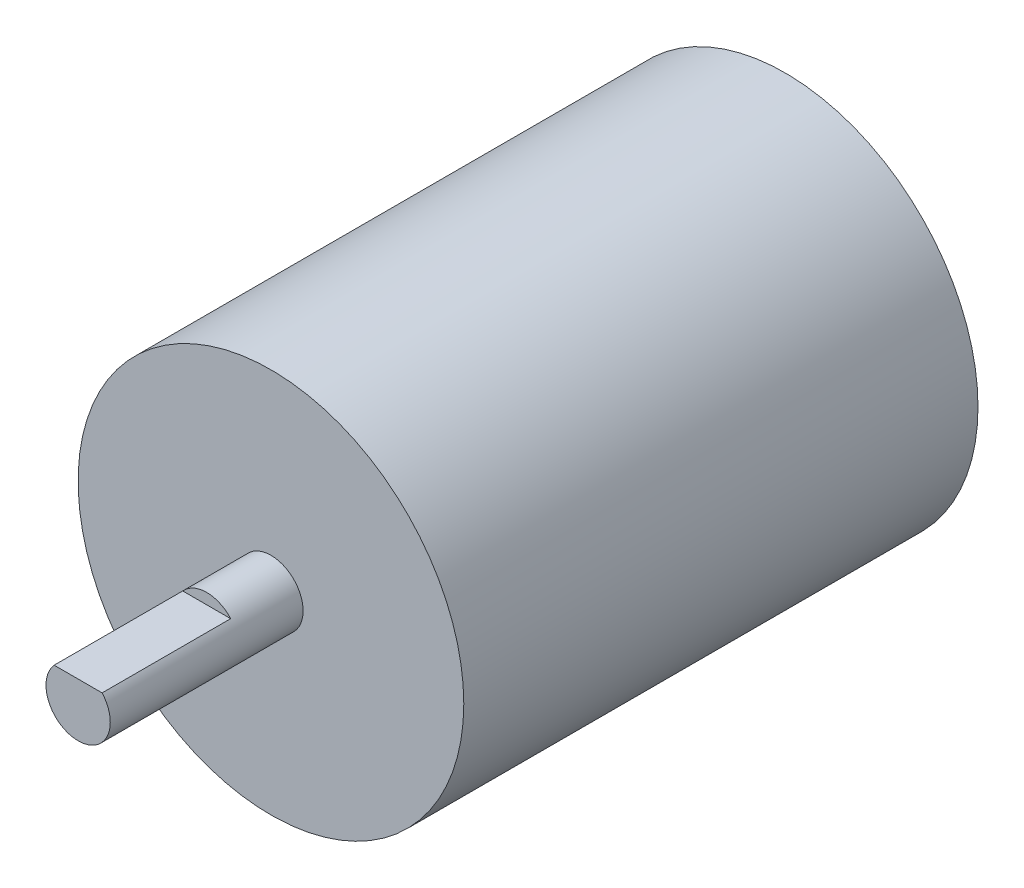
SolidWorks part; units mm, degrees
ref_plane "Front Plane" through (0, 0, 0) normal (0, 0, 1) x (1, 0, 0)
ref_plane "Top Plane" through (0, 0, 0) normal (0, 1, 0) x (1, 0, 0)
ref_plane "Right Plane" through (0, 0, 0) normal (1, 0, 0) x (0, 0, -1)
sketch "Sketch1" plane through (0, 0, 0) normal (0, 0, 1) x (1, 0, 0)
  circle A0 centre (0, 0) radius 19.05
extrude "Boss-Extrude1" add sketch "Sketch1" along normal blind 50.8
sketch "Sketch2" plane through (0, 0, 50.8) normal (0, 0, 1) x (1, 0, 0)
  circle A0 centre (0, 0) radius 3.175
extrude "Boss-Extrude2" add sketch "Sketch2" along normal blind 19.05
sketch "Sketch3" plane through (0, 0, 69.85) normal (0, 0, 1) x (1, 0, 0)
  line L1 (-3.6318, 3.5591) -> (3.9436, 3.5591)
  line L2 (-3.6318, 3.5591) -> (-3.6318, 2.1124)
  line L3 (-3.6318, 2.1124) -> (3.9436, 2.1124)
  line L4 (3.9436, 3.5591) -> (3.9436, 2.1124)
extrude "Cut-Extrude1" cut sketch "Sketch3" against normal blind 12.7
